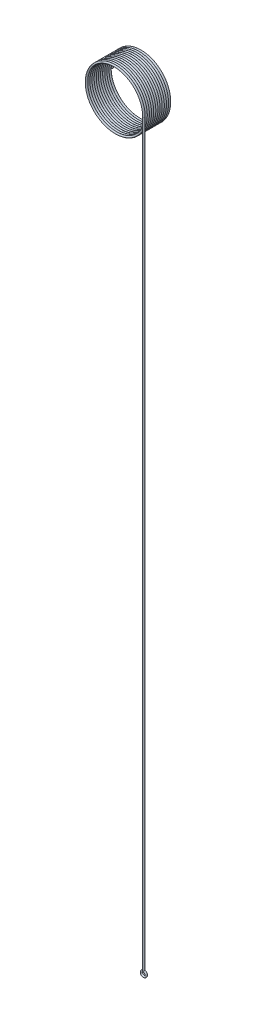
SolidWorks part; units mm, degrees
ref_plane "Спереди" through (0, 0, 0) normal (0, 0, 1) x (1, 0, 0)
ref_plane "Сверху" through (0, 0, 0) normal (0, 1, 0) x (1, 0, 0)
ref_plane "Справа" through (0, 0, 0) normal (1, 0, 0) x (0, 0, -1)
sketch "Эскиз1" plane through (0, 0, 0) normal (0, 0, 1) x (1, 0, 0)
  circle A0 centre (0, 0) radius 19.75
  dimension "D1" = 39.5
curve "Спираль1"
sketch "Эскиз2" plane through (0, 0, 0) normal (0, 0, 1) x (1, 0, 0)
  line L0 (19.75, 0) -> (19.75, -500)
  dimension "D1" = 500
ref_plane "Плоскость1" through (0, -500, 0) normal (0, 1, 0) x (-1, 0, 0)
sketch "Эскиз3" plane through (0, -500, 0) normal (0, 1, 0) x (-1, 0, 0)
  circle A0 centre (-19.75, 0) radius 0.6
  dimension "D1" = 1.2
sweep "По траектории1" add profiles "Эскиз3" path "Эскиз2"
sketch "Эскиз4" plane through (0, 0, 0) normal (0, 1, 0) x (1, 0, 0)
  circle A0 centre (19.75, 0) radius 0.6 construction
  circle A1 centre (19.75, 0) radius 0.6
  dimension "D1" = 1.2
sweep "По траектории2" add profiles "Эскиз4" path "Спираль1"
sketch "Эскиз5" plane through (0, 0, 0) normal (0, 0, 1) x (1, 0, 0)
  line L0 (19.75, 0) -> (19.75, -500) construction
  circle A0 centre (19.75, -501.6) radius 1.6
  dimension "D1" = 3.2
ref_plane "Плоскость2" through (0, -501.6, 0) normal (0, 1, 0) x (-1, 0, 0)
sketch "Эскиз6" plane through (0, -501.6, 0) normal (0, 1, 0) x (-1, 0, 0)
  circle A0 centre (-18.15, 0) radius 0.6
  dimension "D1" = 1.2
sweep "По траектории3" add profiles "Эскиз6" path "Эскиз5"
